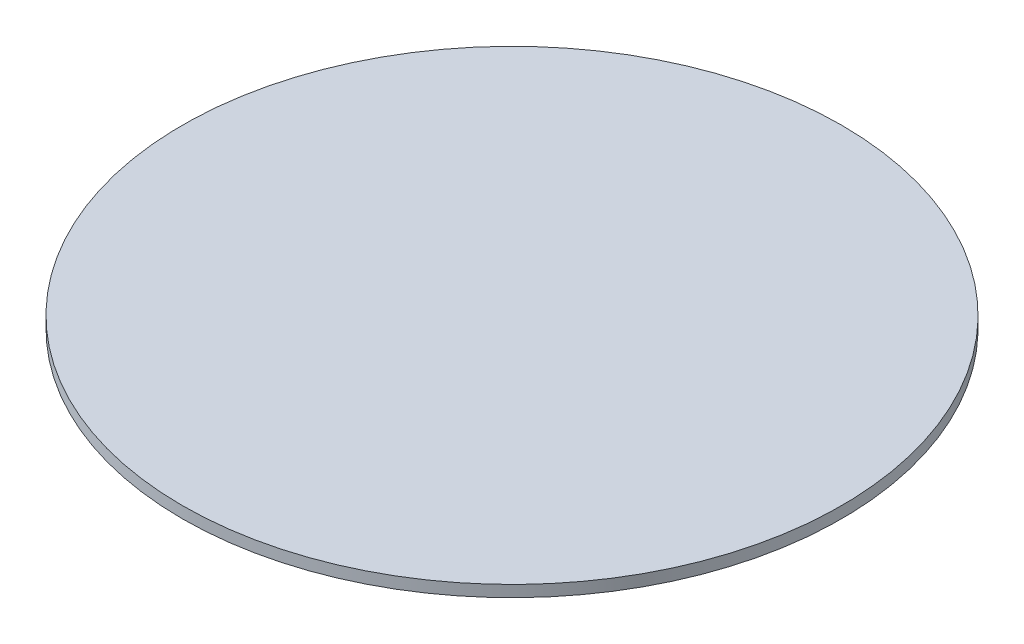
SolidWorks part; units mm, degrees
ref_plane "Front Plane" through (0, 0, 0) normal (0, 0, 1) x (1, 0, 0)
ref_plane "Top Plane" through (0, 0, 0) normal (0, 1, 0) x (1, 0, 0)
ref_plane "Right Plane" through (0, 0, 0) normal (1, 0, 0) x (0, 0, -1)
sketch "Sketch2" plane through (0, 0, 0) normal (0, 1, 0) x (1, 0, 0)
  circle A0 centre (0, 0) radius 460
extrude "Boss-Extrude1" add sketch "Sketch2" along normal blind 16
equation "\"ticknes\"= 16mm"
equation "\"D1@Boss-Extrude1\"=\"ticknes\""
